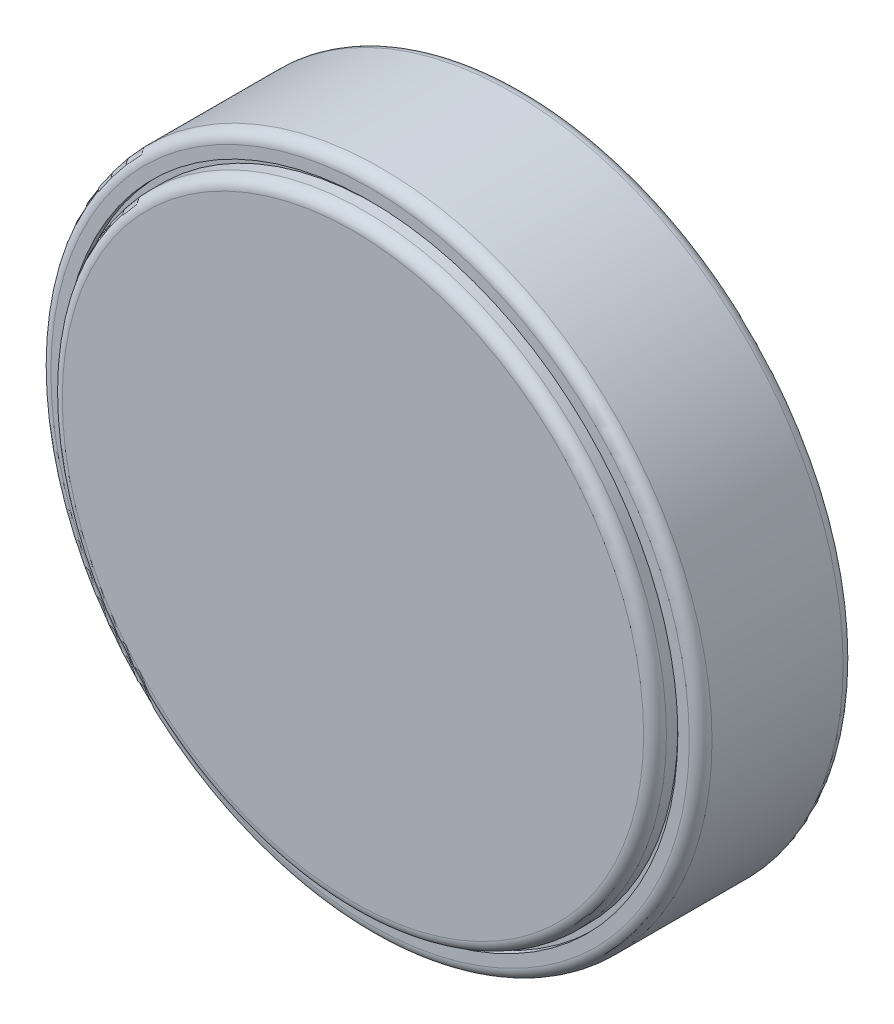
SolidWorks part; units mm, degrees
ref_plane "Plan1" through (0, 0, 0) normal (0, 0, 1) x (1, 0, 0)
ref_plane "Plan2" through (0, 0, 0) normal (0, 1, 0) x (1, 0, 0)
ref_plane "Plan3" through (0, 0, 0) normal (1, 0, 0) x (0, 0, -1)
sketch "Esquisse1" plane through (0, 0, 0) normal (0, 0, 1) x (1, 0, 0)
  circle A0 centre (0, 0) radius 5.8
  dimension "D1" = 11.6
extrude "corps" add sketch "Esquisse1" along normal blind 2.7
sketch "Esquisse2" plane through (0, 0, 2.7) normal (0, 0, 1) x (1, 0, 0)
  circle A2 centre (0, 0) radius 5.3
  circle A3 centre (0, 0) radius 5.3
  dimension "D1" = 0.5
extrude "Boss.-Extru.1" add sketch "Esquisse2" along normal blind 0.3
fillet "Congé1" radius 0.2
sketch "Esquisse3" plane through (0, 0, 2.7) normal (0, 0, 1) x (1, 0, 0)
  circle A2 centre (0, 0) radius 5.3 construction
  circle A5 centre (0, 0) radius 5.3
  circle A6 centre (0, 0) radius 5.4
  dimension "D1" = 0.1
extrude "gorge" cut sketch "Esquisse3" against normal blind 0.1
